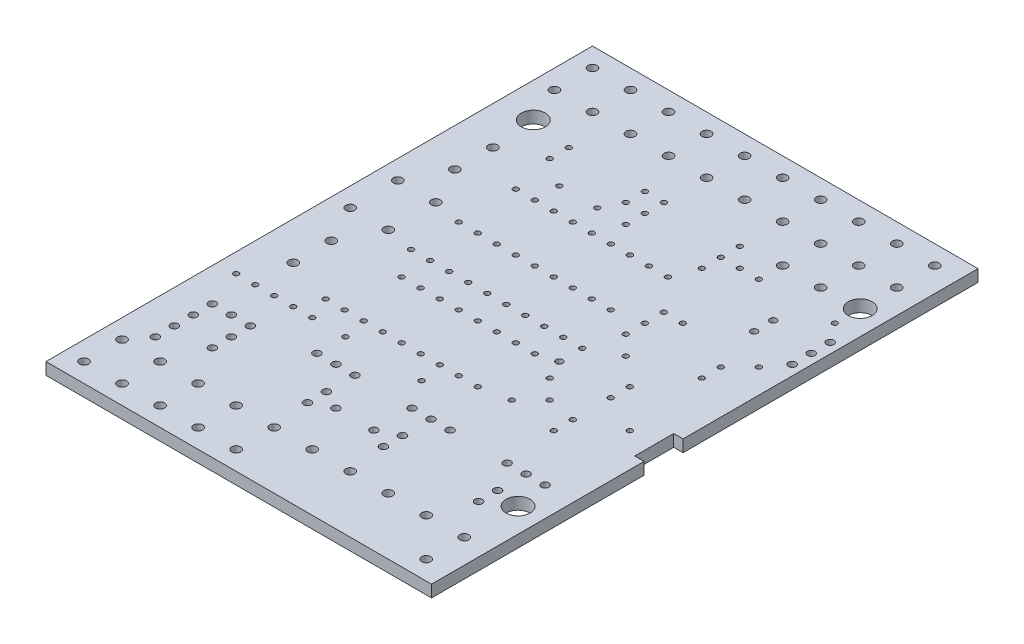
SolidWorks part; units mm, degrees
ref_plane "Plan de face" through (0, 0, 0) normal (0, 0, 1) x (1, 0, 0)
ref_plane "Plan de dessus" through (0, 0, 0) normal (0, 1, 0) x (1, 0, 0)
ref_plane "Plan de droite" through (0, 0, 0) normal (1, 0, 0) x (0, 0, -1)
sketch "Esquisse1" plane through (0, 0, 0) normal (0, 1, 0) x (1, 0, 0)
  line L0 (78.2211, 36.5) -> (57.07, 36.5) construction
  line L1 (0, 0) -> (51.5, 0)
  line L2 (0, 0) -> (0, 73)
  line L3 (0, 73) -> (51.5, 73)
  line L4 (51.5, 0) -> (51.5, 28.4)
  line L5 (78.2211, 0) -> (-8.6906, 0) construction
  line L6 (0, -22.9512) -> (0, 75.2941) construction
  line L7 (2.54, -5.8531) -> (2.54, 39.5485) construction
  line L8 (51.5, 33.6) -> (51.5, 73)
  line L9 (50.25, 33.6) -> (51.5, 33.6)
  line L10 (50.25, 33.6) -> (50.25, 28.4)
  line L11 (50.25, 28.4) -> (51.5, 28.4)
  line L12 (6.0697, 2.54) -> (-8.6906, 2.54) construction
  line L13 (-8.6906, 7.62) -> (6.0697, 7.62) construction
  line L14 (-4.6133, 10.16) -> (6.0697, 10.16) construction
  line L15 (4.44, 4.2814) -> (4.44, 13.1497) construction
  line L16 (18.4829, 19.05) -> (-3.5436, 19.05) construction
  line L17 (18.4829, 22.86) -> (-3.5436, 22.86) construction
  line L18 (17.14, 16.5306) -> (17.14, 24.3046) construction
  line L19 (15.5431, 25.92) -> (-3.5436, 25.92) construction
  line L20 (9.52, 41.275) -> (-3.5436, 41.275) construction
  line L21 (48.26, 10.16) -> (48.26, 68.4102) construction
  line L22 (-3.5436, 38.1) -> (5.7932, 38.1) construction
  line L23 (70.703, 14.8) -> (46.99, 14.8) construction
  line L24 (60.1493, 73) -> (-3.5436, 73) construction
  line L25 (60.1493, 60.5) -> (-3.5436, 60.5) construction
  line L26 (4.6, 75.2941) -> (4.6, 55.9647) construction
  circle A0 centre (2.54, 2.54) radius 0.6
  circle A1 centre (2.54, 7.62) radius 0.6
  circle A2 centre (7.62, 7.62) radius 0.6
  circle A3 centre (7.62, 2.54) radius 0.6
  circle A4 centre (12.7, 7.62) radius 0.6
  circle A5 centre (12.7, 2.54) radius 0.6
  circle A6 centre (17.78, 7.62) radius 0.6
  circle A7 centre (17.78, 2.54) radius 0.6
  circle A8 centre (22.86, 7.62) radius 0.6
  circle A9 centre (22.86, 2.54) radius 0.6
  circle A10 centre (27.94, 7.62) radius 0.6
  circle A11 centre (4.44, 10.16) radius 0.5
  circle A12 centre (33.02, 7.62) radius 0.6
  circle A13 centre (4.44, 12.7) radius 0.5
  circle A14 centre (38.1, 7.62) radius 0.6
  circle A15 centre (4.44, 15.24) radius 0.5
  circle A16 centre (43.18, 7.62) radius 0.6
  circle A17 centre (43.18, 60.3) radius 0.6
  circle A18 centre (48.26, 7.62) radius 0.6
  circle A19 centre (48.26, 2.54) radius 0.6
  circle A20 centre (48.26, 70.46) radius 0.6
  circle A21 centre (48.26, 65.38) radius 0.6
  circle A22 centre (43.18, 70.46) radius 0.6
  circle A23 centre (43.18, 65.38) radius 0.6
  circle A24 centre (38.1, 70.46) radius 0.6
  circle A25 centre (38.1, 65.38) radius 0.6
  circle A26 centre (33.02, 70.46) radius 0.6
  circle A27 centre (33.02, 65.38) radius 0.6
  circle A28 centre (27.94, 70.46) radius 0.6
  circle A29 centre (27.94, 65.38) radius 0.6
  circle A30 centre (22.86, 70.46) radius 0.6
  circle A31 centre (22.86, 65.38) radius 0.6
  circle A32 centre (17.78, 70.46) radius 0.6
  circle A33 centre (17.78, 65.38) radius 0.6
  circle A34 centre (12.7, 70.46) radius 0.6
  circle A35 centre (12.7, 65.38) radius 0.6
  circle A36 centre (7.62, 70.46) radius 0.6
  circle A37 centre (7.62, 65.38) radius 0.6
  circle A38 centre (2.54, 65.38) radius 0.6
  circle A39 centre (2.54, 70.46) radius 0.6
  circle A40 centre (27.94, 2.54) radius 0.6
  circle A41 centre (33.02, 2.54) radius 0.6
  circle A42 centre (38.1, 2.54) radius 0.6
  circle A43 centre (43.18, 2.54) radius 0.6
  circle A44 centre (38.1, 60.3) radius 0.6
  circle A45 centre (4.44, 17.78) radius 0.5
  circle A46 centre (22.22, 12.7) radius 0.5
  circle A47 centre (22.22, 15.24) radius 0.5
  circle A48 centre (6.98, 17.78) radius 0.5
  circle A49 centre (9.52, 12.7) radius 0.5
  circle A50 centre (9.52, 15.24) radius 0.5
  circle A51 centre (9.52, 17.78) radius 0.5
  circle A52 centre (6.98, 12.7) radius 0.5
  circle A53 centre (6.98, 15.24) radius 0.5
  circle A54 centre (32.38, 12.7) radius 0.5
  circle A55 centre (32.38, 15.24) radius 0.5
  circle A56 centre (45.08, 12.7) radius 0.5
  circle A57 centre (45.08, 15.24) radius 0.5
  circle A58 centre (22.22, 19.05) radius 0.5
  circle A59 centre (32.38, 19.05) radius 0.5
  circle A60 centre (45.08, 19.05) radius 0.5
  circle A61 centre (47.62, 19.05) radius 0.5
  circle A62 centre (34.92, 19.05) radius 0.5
  circle A63 centre (42.54, 19.05) radius 0.5
  circle A64 centre (29.84, 19.05) radius 0.5
  circle A65 centre (19.68, 19.05) radius 0.5
  circle A66 centre (2.54, 22.86) radius 0.35
  circle A67 centre (5.08, 22.86) radius 0.35
  circle A68 centre (17.14, 19.05) radius 0.5
  circle A69 centre (40, 19.05) radius 0.5
  circle A70 centre (27.3, 19.05) radius 0.5
  circle A71 centre (7.62, 22.86) radius 0.35
  circle A72 centre (10.16, 22.86) radius 0.35
  circle A73 centre (12.7, 22.86) radius 0.35
  circle A74 centre (17.14, 22.86) radius 0.35
  circle A75 centre (13.97, 25.92) radius 0.35
  circle A76 centre (13.97, 33.54) radius 0.35
  circle A77 centre (13.97, 37.35) radius 0.35
  circle A78 centre (13.97, 43.7) radius 0.35
  circle A79 centre (13.97, 51.32) radius 0.35
  circle A80 centre (11.43, 25.92) radius 0.35
  circle A81 centre (35.56, 31.73) radius 0.35
  circle A82 centre (11.43, 37.35) radius 0.35
  circle A83 centre (11.43, 43.7) radius 0.35
  circle A84 centre (11.43, 51.32) radius 0.35
  circle A85 centre (16.51, 25.92) radius 0.35
  circle A86 centre (16.51, 33.54) radius 0.35
  circle A87 centre (16.51, 37.35) radius 0.35
  circle A88 centre (16.51, 43.7) radius 0.35
  circle A89 centre (16.51, 51.32) radius 0.35
  circle A90 centre (19.05, 25.92) radius 0.35
  circle A91 centre (19.05, 33.54) radius 0.35
  circle A92 centre (19.05, 37.35) radius 0.35
  circle A93 centre (19.05, 43.7) radius 0.35
  circle A94 centre (19.05, 51.32) radius 0.35
  circle A95 centre (21.59, 25.92) radius 0.35
  circle A96 centre (21.59, 33.54) radius 0.35
  circle A97 centre (21.59, 37.35) radius 0.35
  circle A98 centre (21.59, 43.7) radius 0.35
  circle A99 centre (21.59, 51.32) radius 0.35
  circle A100 centre (24.13, 25.92) radius 0.35
  circle A101 centre (24.13, 33.54) radius 0.35
  circle A102 centre (24.13, 37.35) radius 0.35
  circle A103 centre (24.13, 43.7) radius 0.35
  circle A104 centre (24.13, 51.32) radius 0.35
  circle A105 centre (26.67, 25.92) radius 0.35
  circle A106 centre (26.67, 33.54) radius 0.35
  circle A107 centre (26.67, 37.35) radius 0.35
  circle A108 centre (26.67, 43.7) radius 0.35
  circle A109 centre (26.67, 51.32) radius 0.35
  circle A110 centre (29.21, 25.92) radius 0.35
  circle A111 centre (29.21, 33.54) radius 0.35
  circle A112 centre (29.21, 37.35) radius 0.35
  circle A113 centre (29.21, 43.7) radius 0.35
  circle A114 centre (29.21, 51.32) radius 0.35
  circle A115 centre (31.75, 25.92) radius 0.35
  circle A116 centre (31.75, 33.54) radius 0.35
  circle A117 centre (31.75, 37.35) radius 0.35
  circle A118 centre (31.75, 43.7) radius 0.35
  circle A119 centre (31.75, 51.32) radius 0.35
  circle A120 centre (35.56, 26.65) radius 0.35
  circle A121 centre (41.91, 25.92) radius 0.35
  circle A122 centre (34.29, 37.35) radius 0.35
  circle A123 centre (34.29, 34.3) radius 0.45
  circle A124 centre (5.08, 27.94) radius 0.6
  circle A125 centre (41.91, 28.46) radius 0.35
  circle A126 centre (38.1, 57.13) radius 0.35
  circle A127 centre (38.1, 46.97) radius 0.35
  circle A128 centre (5.08, 33.02) radius 0.6
  circle A129 centre (41.91, 33.54) radius 0.35
  circle A130 centre (41.91, 36.08) radius 0.35
  circle A131 centre (46.99, 31) radius 0.35
  circle A132 centre (29.84, 13.97) radius 0.5
  circle A133 centre (24.76, 13.97) radius 0.5
  circle A134 centre (5.08, 49.53) radius 0.6
  circle A135 centre (5.08, 54.61) radius 0.6
  circle A136 centre (2.54, 38.1) radius 0.6
  circle A137 centre (7.62, 38.1) radius 0.6
  circle A138 centre (7.62, 44.45) radius 0.6
  circle A139 centre (2.54, 44.45) radius 0.6
  circle A140 centre (35.56, 57.13) radius 0.35
  circle A141 centre (33.02, 57.13) radius 0.35
  circle A142 centre (33.02, 54.59) radius 0.35
  circle A143 centre (33.02, 59.67) radius 0.35
  circle A144 centre (22.86, 57.13) radius 0.35
  circle A145 centre (22.86, 54.59) radius 0.35
  circle A146 centre (22.86, 59.67) radius 0.35
  circle A147 centre (20.32, 57.13) radius 0.35
  circle A148 centre (20.32, 59.67) radius 0.35
  circle A149 centre (10.16, 57.13) radius 0.35
  circle A150 centre (10.16, 59.67) radius 0.35
  circle A151 centre (19.05, 54.59) radius 0.35
  circle A152 centre (22.22, 13.97) radius 0.5
  circle A153 centre (24.76, 12.7) radius 0.5
  circle A154 centre (34.29, 43.7) radius 0.35
  circle A155 centre (34.29, 51.32) radius 0.35
  circle A156 centre (27.3, 22.86) radius 0.35
  circle A157 centre (13.97, 54.59) radius 0.35
  circle A158 centre (41.91, 31) radius 0.35
  circle A159 centre (38.1, 39.35) radius 0.35
  circle A160 centre (38.1, 29.19) radius 0.35
  circle A161 centre (35.56, 46.97) radius 0.35
  circle A162 centre (35.56, 44.43) radius 0.35
  circle A163 centre (35.56, 41.89) radius 0.35
  circle A164 centre (45.72, 44.43) radius 0.35
  circle A165 centre (45.72, 41.89) radius 0.35
  circle A166 centre (48.26, 46.97) radius 0.35
  circle A167 centre (48.26, 57.13) radius 0.35
  circle A168 centre (48.26, 14.8) radius 1.6
  circle A169 centre (50.16, 49.51) radius 0.5
  circle A170 centre (50.16, 52.05) radius 0.5
  circle A171 centre (50.16, 54.59) radius 0.5
  circle A172 centre (43.81, 53.32) radius 0.45
  circle A173 centre (48.26, 60.5) radius 1.6
  circle A174 centre (43.81, 50.78) radius 0.45
  circle A175 centre (34.29, 25.92) radius 0.35
  circle A176 centre (4.6, 60.5) radius 1.6
  dimension "D5" = 10
  dimension "D8" = 4
  dimension "D18" = 5
  dimension "D19" = 2
  dimension "D25" = 3
  dimension "D26" = 2
  dimension "D27" = 2
  dimension "D23" = 2
  dimension "D28" = 3.175
  dimension "D29" = 2
  dimension "D37" = 14.8
  dimension "D38" = 12.5
  dimension "D39" = 4.6
  dimension "D40" = 2
  dimension "D1" = 36.5
  dimension "D2" = 2.54
  dimension "D3" = 5.08
  dimension "D4" = 2.54
  dimension "D6" = 2.54
  dimension "D7" = 1.9
  dimension "D17" = 3.81
  dimension "D22" = 3.06
  dimension "D9" = 2
  dimension "D10" = 3
  dimension "D11" = 2
  dimension "D12" = 2
  dimension "D13" = 2
  dimension "D14" = 2
  dimension "D15" = 2
  dimension "D16" = 3
  dimension "D24" = 10
  dimension "D21" = 2
  dimension "D30" = 3
  dimension "D31" = 2
  dimension "D32" = 2
  dimension "D20" = 5
  dimension "D33" = 2
  dimension "D34" = 2
  dimension "D35" = 2
  dimension "D36" = 2
extrude "Boss.-Extru.1" add sketch "Esquisse1" along normal blind 1.6
